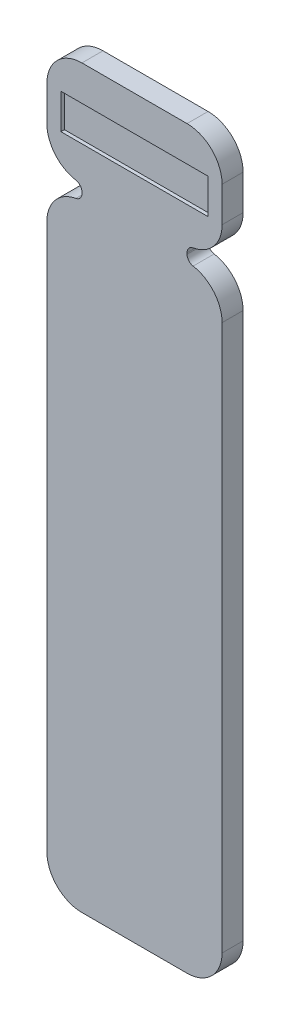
SolidWorks part; units mm, degrees
ref_plane "Plan de face" through (0, 0, 0) normal (0, 0, 1) x (1, 0, 0)
ref_plane "Plan de dessus" through (0, 0, 0) normal (0, 1, 0) x (1, 0, 0)
ref_plane "Plan de droite" through (0, 0, 0) normal (1, 0, 0) x (0, 0, -1)
sketch "Esquisse1" plane through (0, 0, 0) normal (0, 0, 1) x (1, 0, 0)
  line L0 (-50, 35) -> (-50, 20)
  line L1 (-50, 35) -> (-25, 35)
  line L2 (-50, 17.9) -> (-50, -70)
  line L3 (-50, -70) -> (-25, -70)
  line L4 (-25, 17.9) -> (-25, -70)
  line L5 (-50, 20) -> (-45, 20)
  line L6 (-25, 20) -> (-30, 20)
  line L7 (-50, 17.9) -> (-45, 17.9)
  line L8 (-45, 20) -> (-45, 17.9)
  line L9 (-30, 20) -> (-30, 17.9)
  line L10 (-30, 17.9) -> (-25, 17.9)
  line L11 (-25, 35) -> (-25, 20)
  dimension "D1" = 25
  dimension "D2" = 105
  dimension "D3" = 5
  dimension "D4" = 2.1
  dimension "D5" = 15
  dimension "D6" = 5
  dimension "D7" = 2.1
  dimension "D8" = 15
extrude "Extrusion1" add sketch "Esquisse1" along normal blind 3
fillet "Congé1" radius 5 12 edges at (-47.5, 20, 3) (-27.5, 20, 0) (-27.5, 17.9, 0) (-47.5, 17.9, 0) (-47.5, 20, 0) (-47.5, 17.9, 3) (-25, 20, 1.5) (-25, 17.9, 1.5) (-50, 17.9, 1.5) (-50, 20, 1.5) (-27.5, 17.9, 3) (-27.5, 20, 3)
fillet "Congé2" radius 1.05 4 edges at (-30, 20, 1.5) (-30, 17.9, 1.5) (-45, 17.9, 1.5) (-45, 20, 1.5)
fillet "Congé3" radius 5 4 edges at (-25, 35, 1.5) (-25, -70, 1.5) (-50, -70, 1.5) (-50, 35, 1.5)
sketch "Esquisse3" plane through (0, 0, 3) normal (0, 0, 1) x (1, 0, 0)
  line L0 (-25, -65) -> (-25, 12.9) construction
  line L1 (-48, 30) -> (-27, 30)
  line L2 (-48, 30) -> (-48, 25)
  line L3 (-48, 25) -> (-27, 25)
  line L4 (-27, 30) -> (-27, 25)
  line L5 (-50, 30) -> (-50, 25) construction
  line L6 (-30, 35) -> (-45, 35) construction
  dimension "D1" = 2
  dimension "D2" = 2
  dimension "D3" = 5
  dimension "D4" = 5
extrude "Enlèv. mat.-Extru.1" cut sketch "Esquisse3" against normal blind 0.5
